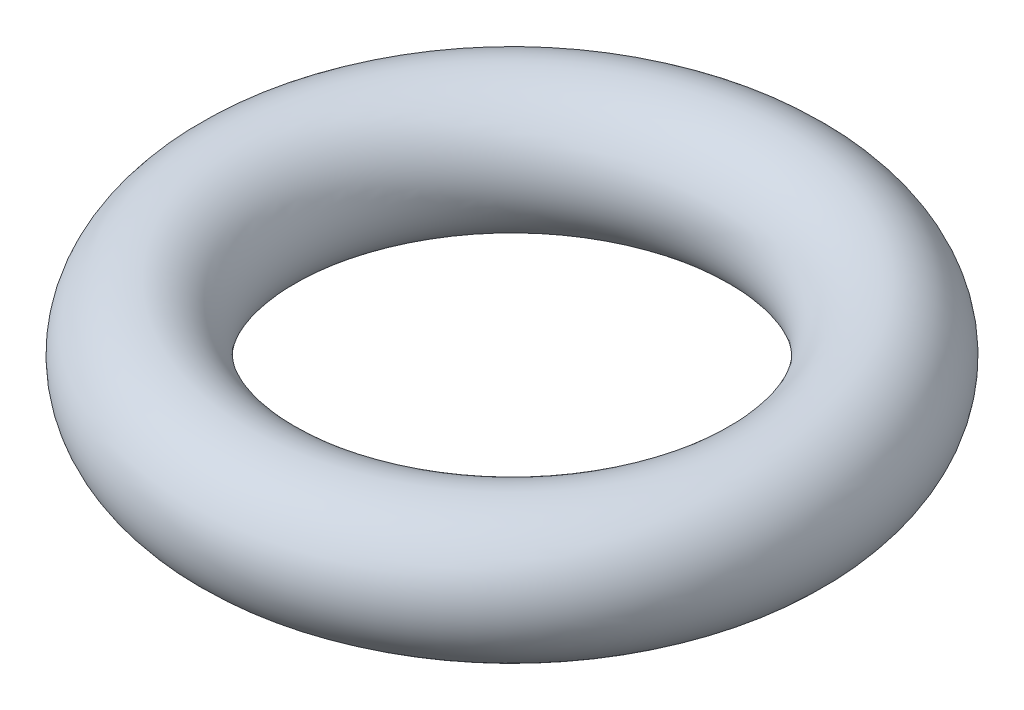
SolidWorks part; units mm, degrees
ref_plane "Plan1" through (0, 0, 0) normal (0, 0, 1) x (1, 0, 0)
ref_plane "Plan2" through (0, 0, 0) normal (0, 1, 0) x (1, 0, 0)
ref_plane "Plan3" through (0, 0, 0) normal (1, 0, 0) x (0, 0, -1)
sketch "Esquisse1" plane through (0, 0, 0) normal (0, 0, 1) x (1, 0, 0)
  line L0 (0, 40) -> (0, -50) construction
  line L1 (-70, 0) -> (70, 0) construction
  line L2 (-4.8, 30) -> (-4.8, -40) construction
  circle A0 centre (-4.8, 0) radius 1.2
  dimension "D2" = 2.4
  dimension "D1" = 4.8
revolve "Base-Révolution" add sketch "Esquisse1" angle 360 about L0
